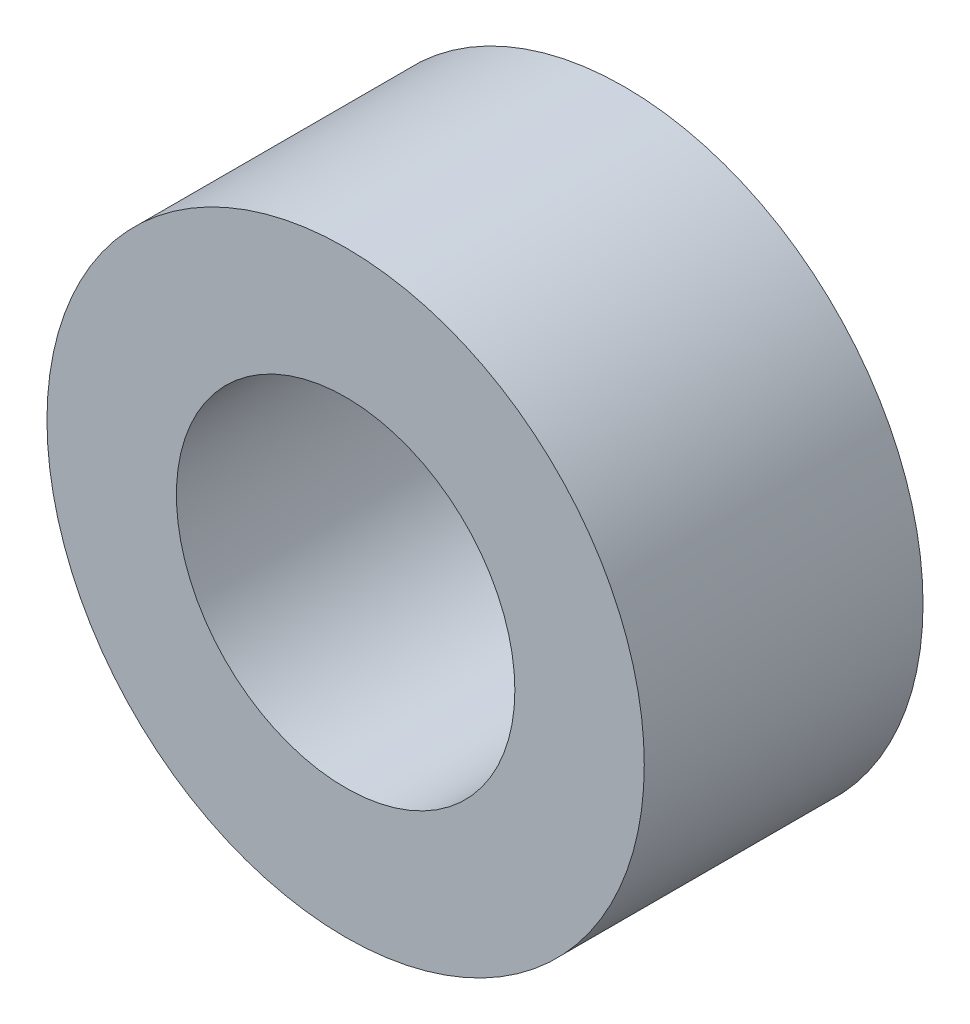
SolidWorks part; units mm, degrees
ref_plane "前视基准面" through (0, 0, 0) normal (0, 0, 1) x (1, 0, 0)
ref_plane "上视基准面" through (0, 0, 0) normal (0, 1, 0) x (1, 0, 0)
ref_plane "右视基准面" through (0, 0, 0) normal (1, 0, 0) x (0, 0, -1)
sketch "草图1" plane through (0, 0, 0) normal (0, 0, 1) x (1, 0, 0)
  circle A0 centre (0, 0) radius 3
  circle A1 centre (0, 0) radius 1.7
  dimension "D1" = 6
  dimension "D2" = 3.4
extrude "凸台-拉伸1" add sketch "草图1" along normal blind 2.8
